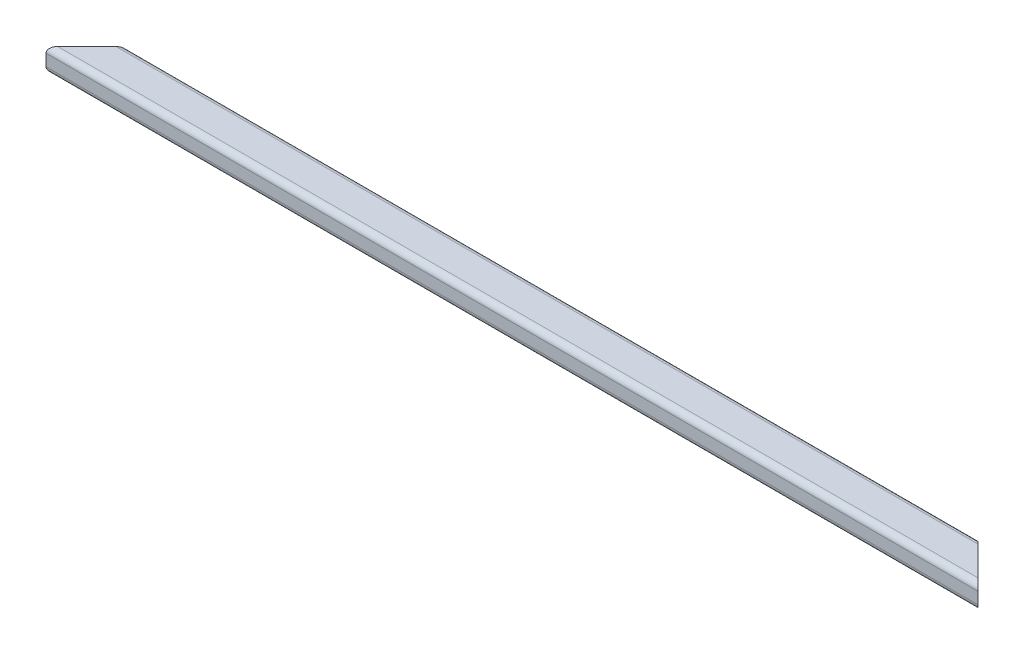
SolidWorks part; units mm, degrees
ref_plane "Plan1" through (0, 0, 0) normal (0, 0, 1) x (1, 0, 0)
ref_plane "Plan2" through (0, 0, 0) normal (0, 1, 0) x (1, 0, 0)
ref_plane "Plan3" through (0, 0, 0) normal (1, 0, 0) x (0, 0, -1)
sketch "Esquisse1" plane through (0, 0, 0) normal (1, 0, 0) x (0, 0, -1)
  line L0 (-17.5, 0) -> (17.5, 0) construction
  line L1 (-12.5, 10) -> (12.5, 10)
  line L2 (-17.5, 5) -> (-17.5, -5)
  line L3 (-12.5, -10) -> (12.5, -10)
  line L4 (17.5, 5) -> (17.5, -5)
  line L5 (0, -10) -> (0, 10) construction
  line L6 (-12.5, 7.5) -> (12.5, 7.5)
  line L7 (15, 5) -> (15, -5)
  line L8 (-12.5, -7.5) -> (12.5, -7.5)
  line L9 (-15, 5) -> (-15, -5)
  arc A0 (17.5, 5) -> (12.5, 10) centre (12.5, 5) ccw
  arc A1 (-17.5, 5) -> (-12.5, 10) centre (-12.5, 5) cw
  arc A2 (-12.5, -10) -> (-17.5, -5) centre (-12.5, -5) cw
  arc A3 (17.5, -5) -> (12.5, -10) centre (12.5, -5) cw
  arc A4 (-15, 5) -> (-12.5, 7.5) centre (-12.5, 5) cw
  arc A5 (15, 5) -> (12.5, 7.5) centre (12.5, 5) ccw
  arc A6 (15, -5) -> (12.5, -7.5) centre (12.5, -5) cw
  arc A7 (-12.5, -7.5) -> (-15, -5) centre (-12.5, -5) cw
  dimension "e" = 2.5
  dimension "C" = 20
  dimension "B" = 35
extrude "Base-Extrusion" add sketch "Esquisse1" along normal blind 800
sketch "Esquisse2" plane through (0, 10, 0) normal (0, 1, 0) x (-1, 0, 0)
  line L0 (-800, 17.5) -> (-765, -17.5)
  line L1 (-800, -17.5) -> (0, -17.5) construction
  line L2 (-765, -17.5) -> (-800, -17.5)
  line L3 (-800, -17.5) -> (-800, 17.5)
  line L4 (0, 17.5) -> (-35, -17.5)
  line L5 (-35, -17.5) -> (0, -17.5)
  line L6 (0, -17.5) -> (0, 17.5)
  dimension "D1" = 35
  dimension "D2" = 35
extrude "Enlèv. mat.-Extru.1" cut sketch "Esquisse2" against normal through all
